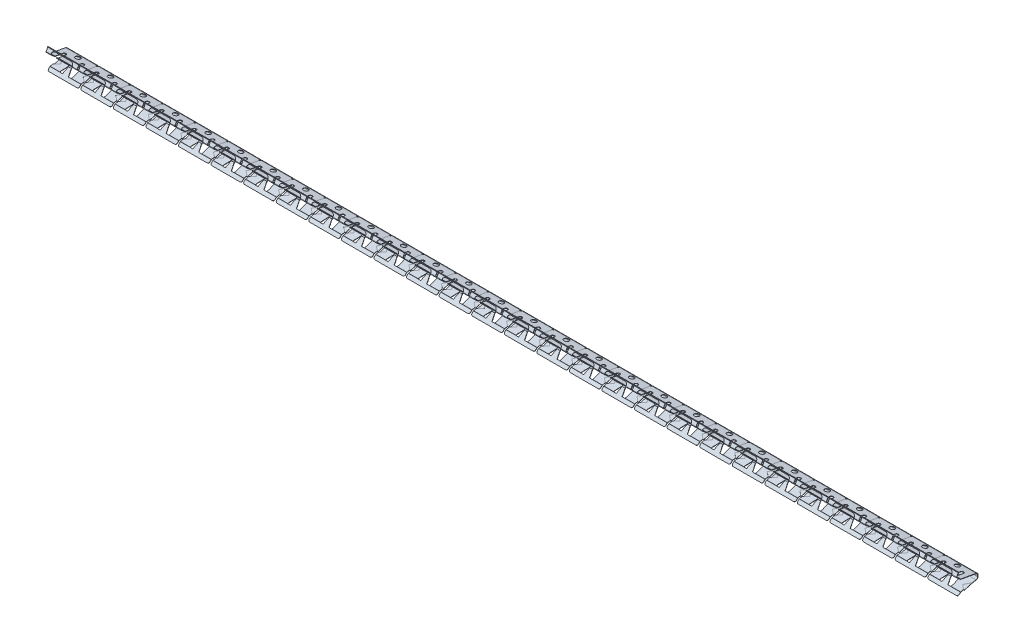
SolidWorks part; units mm, degrees
ref_plane "前视基准面" through (0, 0, 0) normal (0, 0, 1) x (1, 0, 0)
ref_plane "上视基准面" through (0, 0, 0) normal (0, 1, 0) x (1, 0, 0)
ref_plane "右视基准面" through (0, 0, 0) normal (1, 0, 0) x (0, 0, -1)
imported_body "1-1-solid1"
imported_body "1_4-1-solid1"
imported_body "1_5-1-solid1"
imported_body "1_6-1-solid1"
imported_body "1_7-1-solid1"
imported_body "1_9-1-solid1"
imported_body "1_11-1-solid1"
imported_body "1_12-1-solid1"
imported_body "1_13-1-solid1"
imported_body "1_14-1-solid1"
imported_body "1_15-1-solid1"
imported_body "1_17-1-solid1"
imported_body "1_20-1-solid1"
imported_body "1_21-1-solid1"
imported_body "1_22-1-solid1"
imported_body "1_24-1-solid1"
imported_body "1_26-1-solid1"
imported_body "1_27-1-solid1"
imported_body "1_28-1-solid1"
imported_body "1_30-1-solid1"
imported_body "1_31-1-solid1"
imported_body "1_32-1-solid1"
imported_body "1_33-1-solid1"
imported_body "1_34-1-solid1"
imported_body "1_35-1-solid1"
imported_body "1_36-1-solid1"
imported_body "1_38-1-solid1"
imported_body "1_39-1-solid1"
sketch "草图1" plane through (0, 0, 0) normal (0, 1, 0) x (1, 0, 0)
  line L1 (284.23, 0.3048) -> (284.8213, 0.3048)
  line L2 (284.23, 0.3048) -> (284.23, -6.6425)
  line L3 (284.23, -6.6425) -> (284.8213, -6.6425)
  line L4 (284.8213, 0.3048) -> (284.8213, -6.6425)
extrude "切除-拉伸1" cut sketch "草图1" against normal mid plane 35
